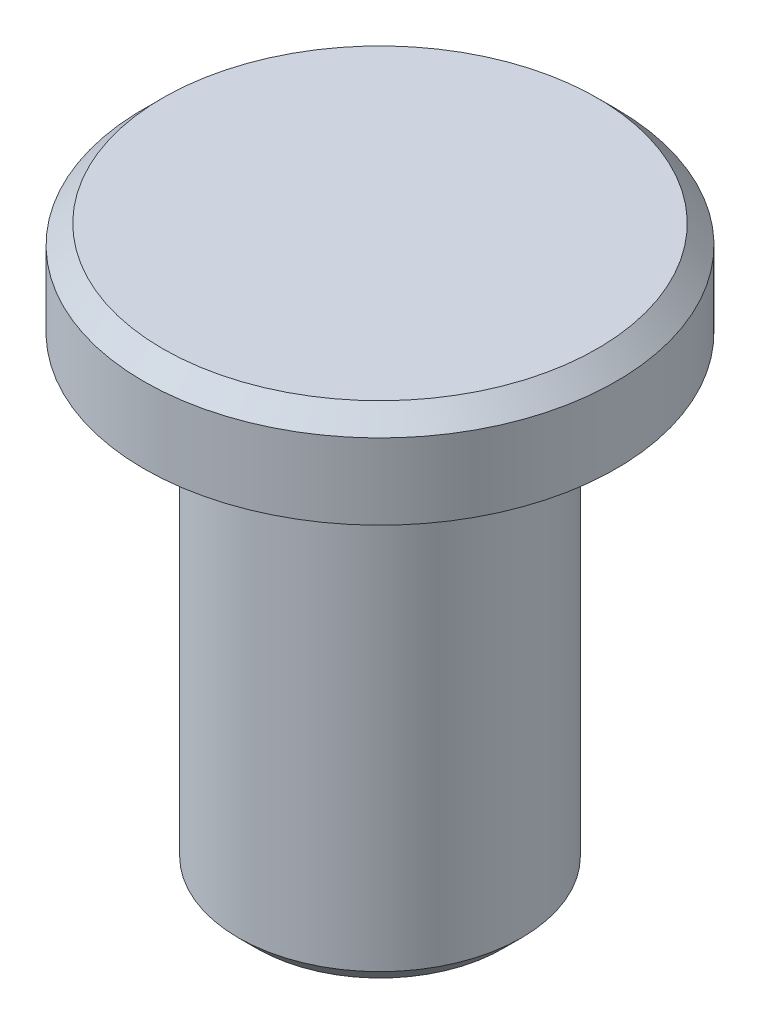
SolidWorks part; units mm, degrees
ref_plane "Front Plane" through (0, 0, 0) normal (0, 0, 1) x (1, 0, 0)
ref_plane "Top Plane" through (0, 0, 0) normal (0, 1, 0) x (1, 0, 0)
ref_plane "Right Plane" through (0, 0, 0) normal (1, 0, 0) x (0, 0, -1)
sketch "Sketch1" plane through (0, 0, 0) normal (0, 1, 0) x (1, 0, 0)
  circle A0 centre (0, 0) radius 1.5
  dimension "D1" = 3
extrude "Boss-Extrude1" add sketch "Sketch1" along normal blind 5
sketch "Sketch2" plane through (0, 5, 0) normal (0, 1, 0) x (1, 0, 0)
  circle A0 centre (0, 0) radius 2.5
  dimension "D1" = 5
extrude "Boss-Extrude2" add sketch "Sketch2" along normal blind 1 contours A0
chamfer "Chamfer1" distance 0.2 angle 45 1 edges at (0, 6, 2.5)
chamfer "Chamfer2" distance 0.2 angle 45 1 edges at (0, 0, 1.5)
